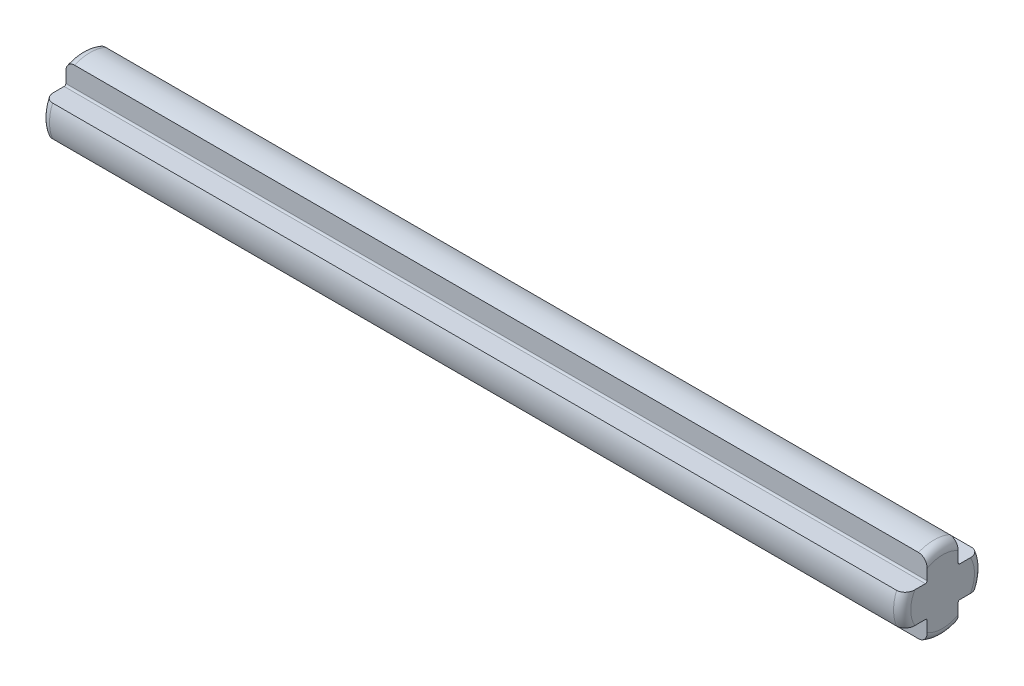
SolidWorks part; units mm, degrees
ref_plane "Alzado" through (0, 0, 0) normal (0, 0, 1) x (1, 0, 0)
ref_plane "Planta" through (0, 0, 0) normal (0, 1, 0) x (1, 0, 0)
ref_plane "Vista lateral" through (0, 0, 0) normal (1, 0, 0) x (0, 0, -1)
sketch "Croquis1" plane through (0, 0, 0) normal (1, 0, 0) x (0, 0, -1)
  line L0 (-3.7919, 0) -> (3.9132, 0) construction
  line L1 (-0.9, 2.1708) -> (-0.9, 1)
  line L2 (-2.1708, 0.9) -> (-1, 0.9)
  line L3 (2.1708, 0.9) -> (1, 0.9)
  line L4 (0.9, 2.1708) -> (0.9, 1)
  line L5 (0, 3.4809) -> (0, -0.8787) construction
  line L6 (0.9, -2.1708) -> (0.9, -1)
  line L7 (2.1708, -0.9) -> (1, -0.9)
  line L8 (-2.1708, -0.9) -> (-1, -0.9)
  line L9 (-0.9, -2.1708) -> (-0.9, -1)
  arc A0 (-2.1708, 0.9) -> (-2.1708, -0.9) centre (0, 0) ccw
  arc A1 (0.9, 2.1708) -> (-0.9, 2.1708) centre (0, 0) ccw
  arc A2 (-1, 0.9) -> (-0.9, 1) centre (-1, 1) ccw
  arc A3 (1, 0.9) -> (0.9, 1) centre (1, 1) cw
  arc A4 (2.1708, 0.9) -> (2.1708, -0.9) centre (0, 0) cw
  arc A5 (1, -0.9) -> (0.9, -1) centre (1, -1) ccw
  arc A6 (-1, -0.9) -> (-0.9, -1) centre (-1, -1) cw
  arc A7 (0.9, -2.1708) -> (-0.9, -2.1708) centre (0, 0) cw
  dimension "D1" = 2.35
  dimension "D4" = 0.1
  dimension "D2" = 1.8
  dimension "D3" = 1.8
extrude "Extruir1" add sketch "Croquis1" along normal mid plane 50
fillet "Redondeo1" radius 0.5 8 edges at (25, 2.35, 0) (25, 0, -2.35) (25, -2.35, 0) (25, 0, 2.35) (-25, -2.35, 0) (-25, 0, -2.35) (-25, 2.35, 0) (-25, 0, 2.35)
